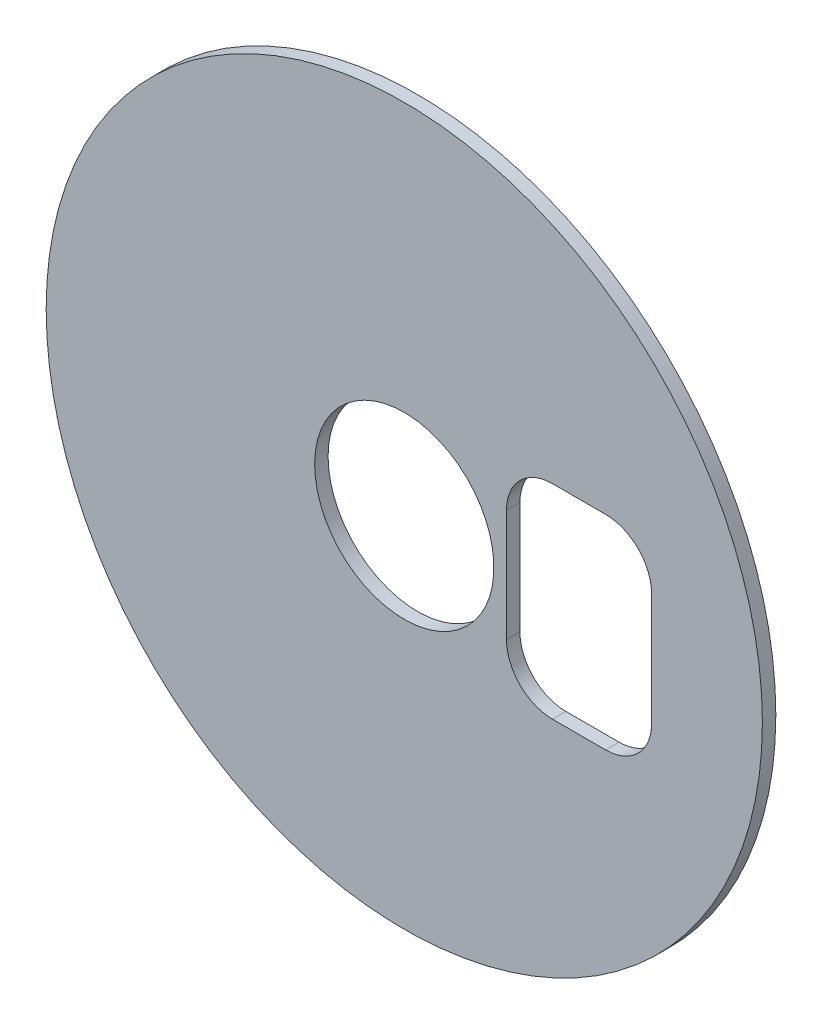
SolidWorks part; units mm, degrees
ref_plane "Front Plane" through (0, 0, 0) normal (0, 0, 1) x (1, 0, 0)
ref_plane "Top Plane" through (0, 0, 0) normal (0, 1, 0) x (1, 0, 0)
ref_plane "Right Plane" through (0, 0, 0) normal (1, 0, 0) x (0, 0, -1)
sketch "Sketch1" plane through (0, 0, 0) normal (0, 0, 1) x (1, 0, 0)
  line L4 (14.0196, -3.175) -> (14.0196, 3.175)
  line L5 (8.3972, -5.7798) -> (11.4148, -5.7798)
  line L6 (5.7924, 3.175) -> (5.7924, -3.175)
  line L7 (11.4148, 5.7798) -> (8.3972, 5.7798)
  circle A1 centre (0, 0) radius 20.2946
  circle A3 centre (0, 0) radius 5.08
  arc A8 (14.0196, 3.175) -> (11.4148, 5.7798) centre (11.4148, 3.175) ccw
  arc A9 (11.4148, -5.7798) -> (14.0196, -3.175) centre (11.4148, -3.175) ccw
  arc A10 (5.7924, -3.175) -> (8.3972, -5.7798) centre (8.3972, -3.175) ccw
  arc A11 (8.3972, 5.7798) -> (5.7924, 3.175) centre (8.3972, 3.175) ccw
extrude "Extrude1" add sketch "Sketch1" along normal blind 0.762
